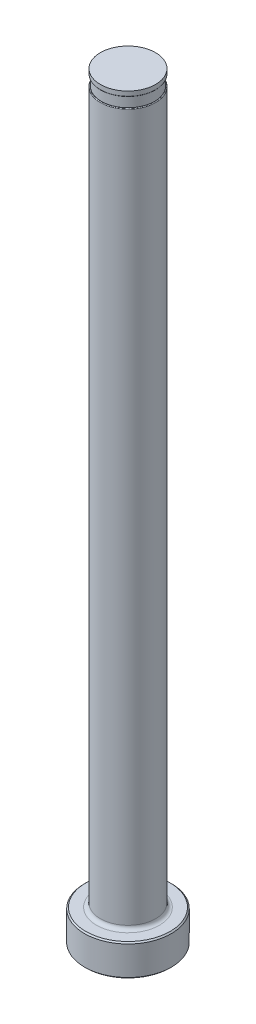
SolidWorks part; units mm, degrees
ref_plane "Front Plane" through (0, 0, 0) normal (0, 0, 1) x (1, 0, 0)
ref_plane "Top Plane" through (0, 0, 0) normal (0, 1, 0) x (1, 0, 0)
ref_plane "Right Plane" through (0, 0, 0) normal (1, 0, 0) x (0, 0, -1)
other "Configuration Table"
sketch "Sketch1" plane through (0, 0, 0) normal (0, 0, 1) x (1, 0, 0)
  line L0 (0, 259.9588) -> (0, -15.1925) construction
  line L1 (0, 0) -> (-8.7249, 0)
  line L2 (-8.7249, 0) -> (-8.7249, 6.35)
  line L3 (-8.7249, 6.35) -> (-5.5562, 6.35)
  line L4 (-5.5562, 6.35) -> (-5.5562, 152.4)
  line L5 (-5.5562, 152.4) -> (0, 152.4)
  line L6 (0, 152.4) -> (0, 0)
  dimension "L" = 152.4
  dimension "H" = 17.4498
  dimension "T" = 6.35
  dimension "D" = 11.1125
revolve "Revolve1" add sketch "Sketch1" angle 360 about L0
chamfer "Chamfer1" distance 0.254 angle 45 2 edges at (0, 6.35, 8.7249) (0, 0, 8.7249)
fillet "Fillet1" radius 0.762 1 edges at (0, 6.35, 5.5562)
sketch "Sketch2" plane through (0, 0, 0) normal (0, 0, 1) x (1, 0, 0)
  line L0 (-5.5562, 152.4) -> (-5.5562, 7.112) construction
  line L1 (-5.5562, 151.384) -> (-5.353, 151.384)
  line L2 (-5.5562, 151.384) -> (-5.5562, 149.352)
  line L3 (-5.5562, 149.352) -> (-5.353, 149.352)
  line L4 (-5.353, 151.384) -> (-5.353, 149.352)
  line L5 (5.5562, 152.4) -> (-5.5562, 152.4) construction
  line L6 (0, 153.4483) -> (0, 147.3282) construction
  dimension "D1" = 2.032
  dimension "N" = 1.016
  dimension "FD" = 0.2032
  dimension "D3" = 10.7061
revolve "Vent Relief" cut sketch "Sketch2" angle 360 about L6
sketch "Sketch3" plane through (0, 0, 0) normal (0, 0, 1) x (1, 0, 0)
  line L0 (-5.353, 150.368) -> (-5.353, 86.868)
  line L1 (-5.353, 151.384) -> (-5.353, 149.352) construction
  line L2 (-5.5562, 149.352) -> (-5.5562, 7.112) construction
  line L3 (-5.5562, 85.7504) -> (-5.5562, 150.368)
  line L4 (-5.5562, 150.368) -> (-5.353, 150.368)
  arc A0 (-5.353, 86.868) -> (-5.5562, 85.7504) centre (-8.528, 86.868) cw
  dimension "D1" = 3.175
  dimension "D2" = 63.5
extrude "D-Slot" cut sketch "Sketch3" against normal through all both and the other way through all
sketch "Sketch5" plane through (0, 0, 0) normal (0, 0, 1) x (1, 0, 0)
  line L0 (-5.5562, 151.384) -> (5.5562, 151.384) construction
  line L1 (-5.5562, 152.4) -> (-5.5512, 152.4)
  line L2 (-5.5562, 152.4) -> (-5.5562, 151.384)
  line L3 (-5.5562, 151.384) -> (-5.5512, 151.384)
  line L4 (-5.5512, 152.4) -> (-5.5512, 151.384)
  line L5 (0, 152.6877) -> (0, 150.5771) construction
  dimension "VP" = 0.0051
revolve "Vent Diameter" cut sketch "Sketch5" angle 360 about L5
fillet "Fillet2" radius 0.127 2 edges at (5.5562, 149.352, 0) (0, 151.384, 5.5512)
sketch "Pocket Sketch" plane through (0, 0, 0) normal (0, 0, 1) x (1, 0, 0)
  line L0 (-9.1218, 0) -> (-9.1218, 6.3754)
  line L1 (-9.1218, 6.3754) -> (-6.5167, 6.3754)
  line L2 (-5.7547, 7.1374) -> (-5.7547, 22.225)
  line L3 (-5.7547, 22.225) -> (0, 22.225)
  line L4 (0, 22.225) -> (0, 0)
  line L5 (0, 0) -> (-9.1218, 0)
  line L6 (0, 12.6104) -> (0, -2.4989) construction
  line L7 (-8.7249, 6.096) -> (-8.7249, 0.254) construction
  line L8 (8.4709, 6.35) -> (-8.4709, 6.35) construction
  line L9 (-5.5562, 85.7504) -> (-5.5562, 7.112) construction
  line L10 (-6.5167, 6.3754) -> (-5.7547, 7.1374)
  point P3 (-5.7547, 6.3754)
  dimension "D1" = 18.2435
  dimension "D2" = 0.3969
  dimension "D3" = 0.0254
  dimension "D4" = 0.1984
  dimension "D5" = 11.5094
  dimension "D6" = 22.225
